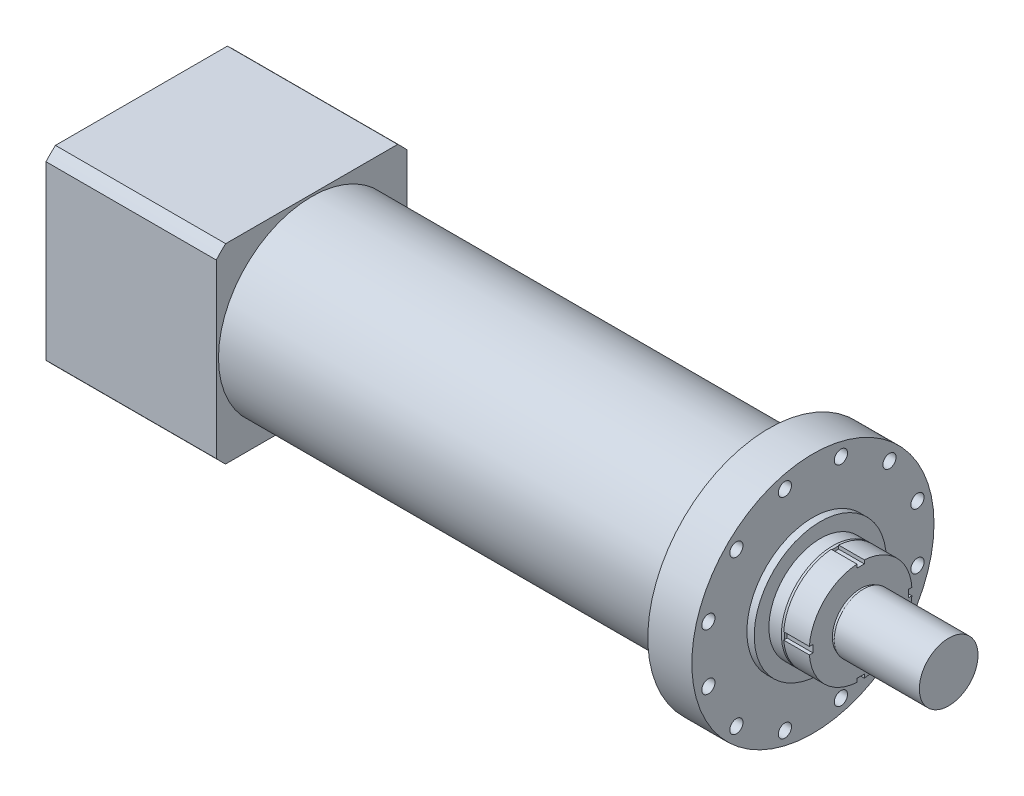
SolidWorks part; units mm, degrees
ref_plane "前视基准面" through (0, 0, 0) normal (0, 0, 1) x (1, 0, 0)
ref_plane "上视基准面" through (0, 0, 0) normal (0, 1, 0) x (1, 0, 0)
ref_plane "右视基准面" through (0, 0, 0) normal (1, 0, 0) x (0, 0, -1)
sketch "草图1" plane through (0, 0, 0) normal (1, 0, 0) x (0, 0, -1)
  circle A0 centre (0, 0) radius 127
  circle A1 centre (0, 0) radius 110
  dimension "D1" = 254
  dimension "D2" = 220
extrude "凸台-拉伸1" add sketch "草图1" along normal blind 623
sketch "草图2" plane through (623, 0, 0) normal (1, 0, 0) x (0, 0, -1)
  circle A0 centre (0, 0) radius 165
  point P0 (0, 0)
  dimension "D1" = 330
extrude "凸台-拉伸2" add sketch "草图2" along normal blind 60 separate body
sketch "草图3" plane through (683, 0, 0) normal (1, 0, 0) x (0, 0, -1)
  circle A0 centre (0, 0) radius 90
  dimension "D1" = 180
extrude "凸台-拉伸3" add sketch "草图3" along normal blind 10
sketch "草图4" plane through (683, 0, 0) normal (1, 0, 0) x (0, 0, -1)
  line L0 (0, 0) -> (38.1758, 142.4741) construction
  line L1 (0, 0) -> (0, 211.0482) construction
  circle A0 centre (0, 0) radius 147.5 construction
  circle A1 centre (38.1758, 142.4741) radius 9
  circle A2 centre (104.2983, 104.2983) radius 9
  circle A3 centre (142.4741, 38.1758) radius 9
  circle A4 centre (142.4741, -38.1758) radius 9
  circle A5 centre (104.2983, -104.2983) radius 9
  circle A6 centre (38.1758, -142.4741) radius 9
  circle A7 centre (-38.1758, -142.4741) radius 9
  circle A8 centre (-104.2983, -104.2983) radius 9
  circle A9 centre (-142.4741, -38.1758) radius 9
  circle A10 centre (-142.4741, 38.1758) radius 9
  circle A11 centre (-104.2983, 104.2983) radius 9
  circle A12 centre (-38.1758, 142.4741) radius 9
  point P30 (0, 0)
  dimension "D1" = 295
  dimension "D3" = 18
  dimension "D2" = 15
  dimension "D4" = 12
extrude "切除-拉伸1" cut sketch "草图4" against normal blind 60
sketch "草图5" plane through (693, 0, 0) normal (1, 0, 0) x (0, 0, -1)
  circle A0 centre (0, 0) radius 70
  dimension "D1" = 140
extrude "凸台-拉伸4" add sketch "草图5" along normal blind 20
chamfer "倒角1" distance 3 angle 20 1 edges at (713, 0, -70)
sketch "草图7" plane through (713, 0, 0) normal (1, 0, 0) x (0, 0, -1)
  circle A0 centre (0, 0) radius 70
  dimension "D1" = 140
extrude "凸台-拉伸5" add sketch "草图7" along normal blind 35
sketch "草图8" plane through (748, 0, 0) normal (1, 0, 0) x (0, 0, -1)
  circle A0 centre (0, 0) radius 38.5
  dimension "D1" = 77
extrude "凸台-拉伸6" add sketch "草图8" along normal blind 4
sketch "草图9" plane through (752, 0, 0) normal (1, 0, 0) x (0, 0, -1)
  circle A0 centre (0, 0) radius 40
  dimension "D1" = 80
extrude "凸台-拉伸7" add sketch "草图9" along normal blind 116
sketch "草图10" plane through (748, 0, 0) normal (1, 0, 0) x (0, 0, -1)
  line L0 (-5, -77.2193) -> (-5, -65)
  line L1 (5, -77.2193) -> (5, -65)
  line L2 (-76.4659, 5) -> (-65, 5)
  line L3 (98.9652, -5) -> (65, -5)
  line L4 (-65, 5) -> (-65, -5)
  line L5 (65, 5) -> (65, -5)
  line L6 (-5, 65) -> (5, 65)
  line L7 (-5, -65) -> (5, -65)
  line L8 (-76.4659, 5) -> (-79.4605, -5)
  line L9 (98.9652, 5) -> (98.9652, -5)
  line L10 (-5, 100.6875) -> (5, 100.6875)
  line L11 (-5, -77.2193) -> (5, -77.2193)
  line L12 (5, 65) -> (5, 100.6875)
  line L13 (-5, 65) -> (-5, 100.6875)
  line L15 (-65, -5) -> (-79.4605, -5)
  line L19 (65, 5) -> (98.9652, 5)
  dimension "D1" = 5
  dimension "D2" = 5
  dimension "D3" = 5
  dimension "D4" = 5
  dimension "D5" = 65
  dimension "D6" = 65
  dimension "D7" = 65
  dimension "D8" = 65
extrude "切除-拉伸2" cut sketch "草图10" against normal blind 35 contours L10 L12 L6 L13 | L19 L9 L3 L5 | L0 L7 L1 L11 | L8 L15 L4 L2
sketch "草图11" plane through (0, 0, 0) normal (-1, 0, 0) x (0, 0, 1)
  circle A0 centre (0, 0) radius 130
  dimension "D1" = 260
extrude "凸台-拉伸8" add sketch "草图11" along normal blind 162 separate body
sketch "草图15" plane through (-162, 0, 0) normal (-1, 0, 0) x (0, 0, 1)
  line L1 (-117.1537, 130) -> (117.1537, 130)
  line L2 (-130, 117.1537) -> (-130, -117.1537)
  line L3 (-117.1537, -130) -> (117.1537, -130)
  line L4 (130, 117.1537) -> (130, -117.1537)
  line L5 (-123.7437, 123.7437) -> (123.7437, -123.7437) construction
  line L6 (-123.7437, -123.7437) -> (123.7437, 123.7437) construction
  arc A0 (117.1537, -130) -> (130, -117.1537) centre (0, 0) ccw
  arc A1 (-130, -117.1537) -> (-117.1537, -130) centre (0, 0) ccw
  arc A2 (130, 117.1537) -> (117.1537, 130) centre (0, 0) ccw
  arc A3 (-117.1537, 130) -> (-130, 117.1537) centre (0, 0) ccw
  point P0 (0, 0)
  dimension "D3" = 350
extrude "凸台-拉伸10" add sketch "草图15" along normal blind 70 separate body
sketch "草图16" plane through (-232, 0, 0) normal (-1, 0, 0) x (0, 0, 1)
  circle A0 centre (0, 0) radius 80
  dimension "D1" = 160
extrude "切除-拉伸4" cut sketch "草图16" against normal blind 26
sketch "草图17" plane through (-206, 0, 0) normal (-1, 0, 0) x (0, 0, 1)
  circle A0 centre (0, 0) radius 81.5
  dimension "D1" = 163
extrude "切除-拉伸5" cut sketch "草图17" against normal blind 38
sketch "草图18" plane through (-162, 0, 0) normal (1, 0, 0) x (0, 0, -1)
  line L0 (130, 117.1537) -> (130, -117.1537) construction
  line L1 (117.1537, -130) -> (-117.1537, -130) construction
  line L2 (-130, -117.1537) -> (-130, 117.1537) construction
  line L3 (-117.1537, 130) -> (117.1537, 130) construction
  line L4 (130, 117.1537) -> (130, -117.1537)
  line L5 (117.1537, -130) -> (-117.1537, -130)
  line L6 (-130, -117.1537) -> (-130, 117.1537)
  line L7 (-117.1537, 130) -> (117.1537, 130)
  arc A0 (117.1537, -130) -> (130, -117.1537) centre (0, 0) ccw construction
  arc A1 (130, 117.1537) -> (117.1537, 130) centre (0, 0) ccw construction
  arc A2 (-130, -117.1537) -> (-117.1537, -130) centre (0, 0) ccw construction
  arc A3 (-117.1537, 130) -> (-130, 117.1537) centre (0, 0) ccw construction
  arc A4 (117.1537, -130) -> (130, -117.1537) centre (0, 0) ccw
  arc A5 (130, 117.1537) -> (117.1537, 130) centre (0, 0) ccw
  arc A6 (-130, -117.1537) -> (-117.1537, -130) centre (0, 0) ccw
  arc A7 (-117.1537, 130) -> (-130, 117.1537) centre (0, 0) ccw
extrude "凸台-拉伸11" add sketch "草图18" along normal blind 162
